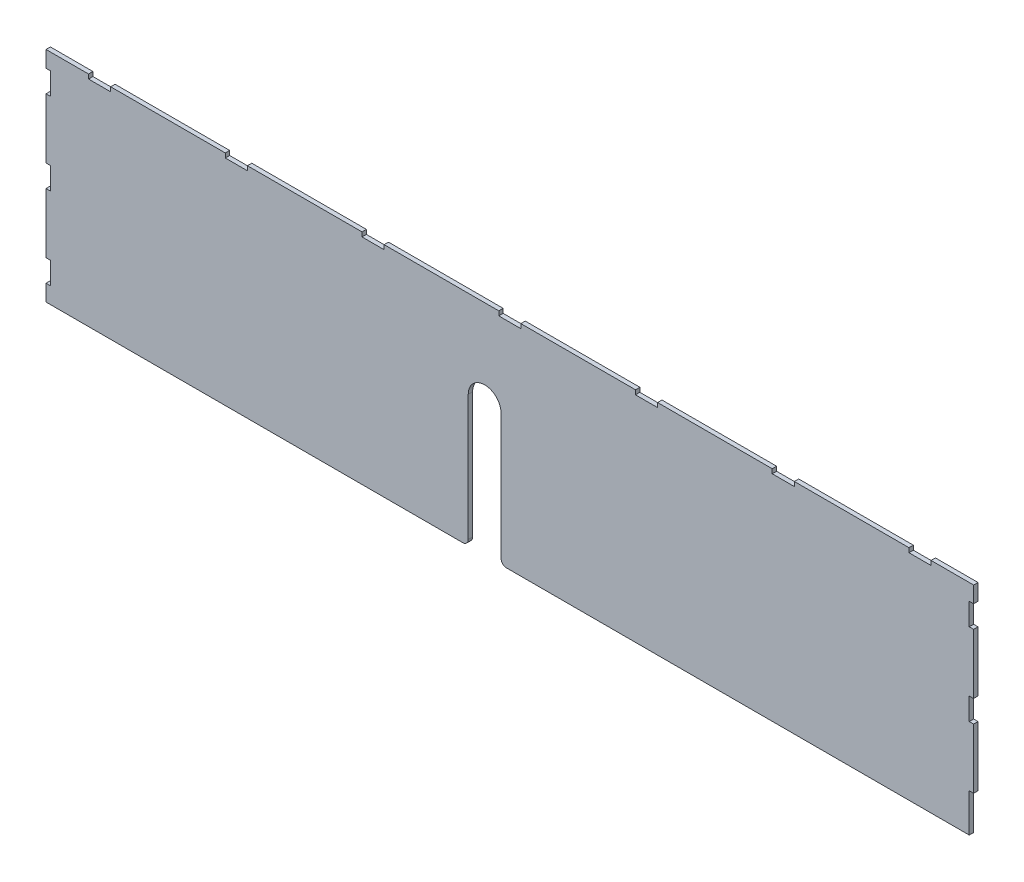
SolidWorks part; units mm, degrees
ref_plane "Ebene vorne" through (0, 0, 0) normal (0, 0, 1) x (1, 0, 0)
ref_plane "Ebene oben" through (0, 0, 0) normal (0, 1, 0) x (1, 0, 0)
ref_plane "Ebene rechts" through (0, 0, 0) normal (1, 0, 0) x (0, 0, -1)
sketch "Skizze1" plane through (0, 0, 0) normal (0, 0, 1) x (1, 0, 0)
  line L1 (-424, -100) -> (424, -100)
  line L2 (-424, -100) -> (-424, 100)
  line L3 (-424, 100) -> (424, 100)
  line L4 (424, -100) -> (424, 100)
  line L5 (-424, -100) -> (424, 100) construction
  line L6 (-424, 100) -> (424, -100) construction
  point P0 (0, 0)
  dimension "D1" = 848
  dimension "D2" = 200
extrude "Aufsatz-Linear austragen1" add sketch "Skizze1" along normal blind 4
sketch "Skizze2" plane through (0, 0, 4) normal (0, 0, 1) x (1, 0, 0)
  line L0 (-424, 100) -> (-424, -100) construction
  line L5 (-424, -85.1) -> (-420, -85.1)
  line L6 (-424, -85.1) -> (-424, -64.9)
  line L7 (-424, -64.9) -> (-420, -64.9)
  line L8 (-420, -85.1) -> (-420, -64.9)
  line L9 (-424, -10.1) -> (-420, -10.1)
  line L10 (-424, -10.1) -> (-424, 10.1)
  line L11 (-424, 10.1) -> (-420, 10.1)
  line L12 (-420, -10.1) -> (-420, 10.1)
  line L13 (424, -100) -> (424, 100) construction
  line L14 (-424, 85.1) -> (-420, 85.1)
  line L15 (-424, 85.1) -> (-424, 64.9)
  line L16 (-424, 64.9) -> (-420, 64.9)
  line L17 (-420, 85.1) -> (-420, 64.9)
  line L18 (424, 85.1) -> (420, 85.1)
  line L19 (424, 85.1) -> (424, 64.9)
  line L20 (424, 64.9) -> (420, 64.9)
  line L21 (420, 85.1) -> (420, 64.9)
  line L22 (-424, -100) -> (424, -100) construction
  line L23 (424, 10.1) -> (420, 10.1)
  line L24 (424, 10.1) -> (424, -10.1)
  line L25 (424, -10.1) -> (420, -10.1)
  line L26 (420, 10.1) -> (420, -10.1)
  line L27 (424, -64.9) -> (420, -64.9)
  line L28 (424, -64.9) -> (424, -100)
  line L29 (424, -100) -> (420, -100)
  line L30 (420, -64.9) -> (420, -100)
  line L31 (424, 100) -> (-424, 100) construction
  line L32 (0, 0) -> (0, 96) construction
  line L33 (-385.1, 100) -> (-364.9, 100)
  line L34 (-385.1, 100) -> (-385.1, 96)
  line L35 (-385.1, 96) -> (-364.9, 96)
  line L36 (-364.9, 100) -> (-364.9, 96)
  line L37 (-260.1, 100) -> (-239.9, 100)
  line L38 (-260.1, 100) -> (-260.1, 96)
  line L39 (-260.1, 96) -> (-239.9, 96)
  line L40 (-239.9, 100) -> (-239.9, 96)
  line L41 (-135.1, 100) -> (-114.9, 100)
  line L42 (-135.1, 100) -> (-135.1, 96)
  line L43 (-135.1, 96) -> (-114.9, 96)
  line L44 (-114.9, 100) -> (-114.9, 96)
  line L45 (-10.1, 100) -> (10.1, 100)
  line L46 (-10.1, 100) -> (-10.1, 96)
  line L47 (-10.1, 96) -> (10.1, 96)
  line L48 (10.1, 100) -> (10.1, 96)
  line L49 (114.9, 100) -> (135.1, 100)
  line L50 (114.9, 100) -> (114.9, 96)
  line L51 (114.9, 96) -> (135.1, 96)
  line L52 (135.1, 100) -> (135.1, 96)
  line L53 (239.9, 100) -> (260.1, 100)
  line L54 (239.9, 100) -> (239.9, 96)
  line L55 (239.9, 96) -> (260.1, 96)
  line L56 (260.1, 100) -> (260.1, 96)
  line L57 (364.9, 100) -> (385.1, 100)
  line L58 (364.9, 100) -> (364.9, 96)
  line L59 (364.9, 96) -> (385.1, 96)
  line L60 (385.1, 100) -> (385.1, 96)
  line L61 (-420, 0) -> (0, 0) construction
  point P3 (0, 100)
  point P36 (-424, 75)
  point P68 (-125, 100)
  point P70 (-250, 100)
  point P71 (-375, 100)
  point P72 (125, 100)
  point P75 (250, 100)
  point P76 (375, 100)
  point P83 (-424, 0)
  point P84 (-424, -75)
  dimension "D1" = 20.2
  dimension "D2" = 75
  dimension "D3" = 75
  dimension "D4" = 125
  dimension "D5" = 125
  dimension "D6" = 125
  dimension "D7" = 20.2
  dimension "D8" = 125
  dimension "D9" = 125
  dimension "D10" = 125
  dimension "D11" = 4
extrude "Schnitt-Linear austragen1" cut sketch "Skizze2" against normal through all
sketch "Skizze3" plane through (0, 0, 4) normal (0, 0, 1) x (1, 0, 0)
  line L5 (-38, -100) -> (-38, 20)
  line L6 (-424, -100) -> (420, -100) construction
  line L7 (-8, 20) -> (-8, -100)
  line L8 (-8, -100) -> (-38, -100)
  arc A0 (-38, 20) -> (-8, 20) centre (-23, 20) cw
  dimension "D1" = 23
  dimension "D2" = 30
  dimension "D3" = 120
extrude "Schnitt-Linear austragen2" cut sketch "Skizze3" against normal through all
fillet "Verrundung1" radius 5 2 edges at (-8, -100, 2) (-38, -100, 2)
